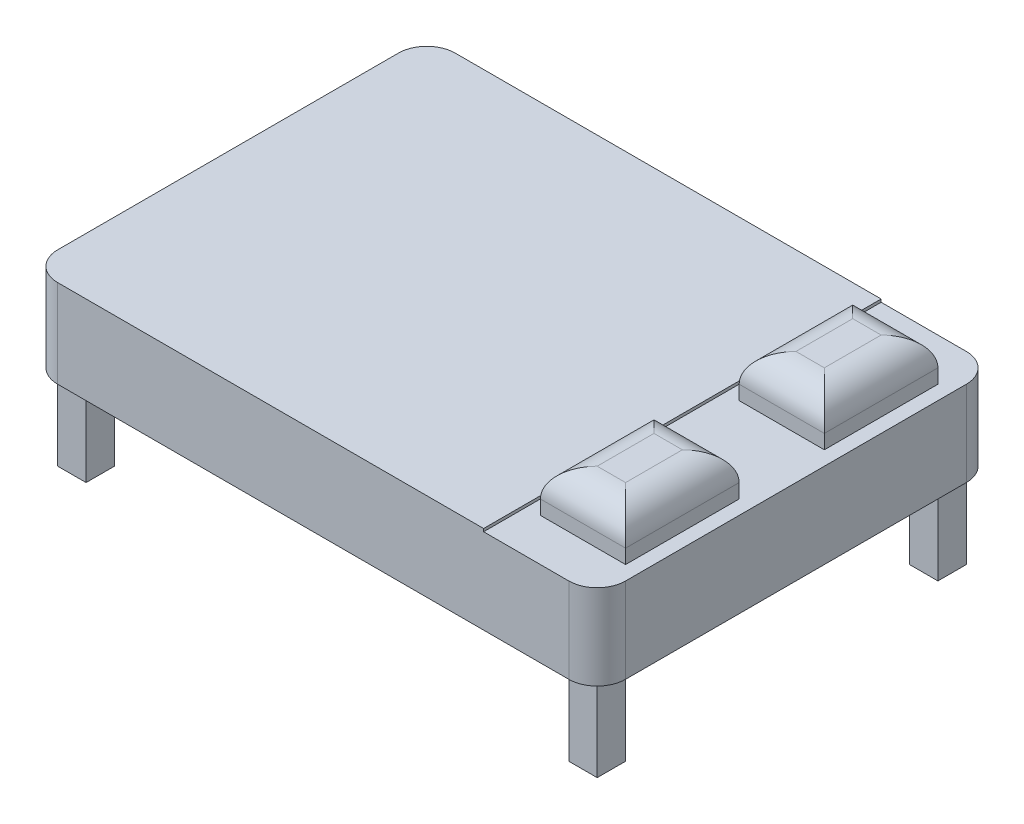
SolidWorks part; units mm, degrees
ref_plane "Plan de face" through (0, 0, 0) normal (0, 0, 1) x (1, 0, 0)
ref_plane "Plan de dessus" through (0, 0, 0) normal (0, 1, 0) x (1, 0, 0)
ref_plane "Plan de droite" through (0, 0, 0) normal (1, 0, 0) x (0, 0, -1)
sketch "Esquisse1" plane through (0, 0, 0) normal (0, 1, 0) x (1, 0, 0)
  line L1 (1000, -700) -> (-1000, -700)
  line L2 (1000, -700) -> (1000, 700)
  line L3 (1000, 700) -> (-1000, 700)
  line L4 (-1000, -700) -> (-1000, 700)
  line L5 (1000, -700) -> (-1000, 700) construction
  line L6 (1000, 700) -> (-1000, -700) construction
  point P0 (0, 0)
  dimension "D1" = 2000
  dimension "D2" = 1400
extrude "Boss.-Extru.1" add sketch "Esquisse1" along normal blind 300
sketch "Esquisse2" plane through (0, 0, 0) normal (0, -1, 0) x (1, 0, 0)
  line L0 (-1000, 700) -> (1000, 700) construction
  line L1 (-950, 650) -> (-850, 650)
  line L2 (-950, 650) -> (-950, 550)
  line L3 (-950, 550) -> (-850, 550)
  line L4 (-850, 650) -> (-850, 550)
  line L5 (-950, 650) -> (-850, 550) construction
  line L6 (-950, 550) -> (-850, 650) construction
  line L7 (-1000, -700) -> (-1000, 700) construction
  point P0 (-900, 600)
  dimension "D1" = 100
  dimension "D2" = 100
  dimension "D3" = 50
  dimension "D4" = 50
extrude "Boss.-Extru.2" add sketch "Esquisse2" along normal blind 300
mirror "Symétrie1" about plane through (0, 0, 0) normal (0, 0, 1) of "Boss.-Extru.2"
mirror "Symétrie2" about plane through (0, 0, 0) normal (1, 0, 0) of "Symétrie1", "Boss.-Extru.2"
sketch "Esquisse3" plane through (0, 300, 0) normal (0, 1, 0) x (1, 0, 0)
  line L0 (-1000, -700) -> (1000, -700) construction
  line L1 (-1000, 700) -> (600, 700)
  line L2 (-1000, 700) -> (-1000, -700)
  line L3 (-1000, -700) -> (600, -700)
  line L4 (600, 700) -> (600, -700)
  dimension "D1" = 1600
extrude "Boss.-Extru.3" add sketch "Esquisse3" along normal blind 10
sketch "Esquisse4" plane through (0, 300, 0) normal (0, 1, 0) x (1, 0, 0)
  line L0 (1000, -700) -> (1000, 700) construction
  line L1 (650, 550) -> (950, 550)
  line L2 (650, 550) -> (650, 150)
  line L3 (650, 150) -> (950, 150)
  line L4 (950, 550) -> (950, 150)
  line L5 (650, -150) -> (950, -150)
  line L6 (650, -150) -> (650, -550)
  line L7 (650, -550) -> (950, -550)
  line L8 (950, -150) -> (950, -550)
  line L9 (600, -700) -> (1000, -700) construction
  line L10 (1000, 700) -> (600, 700) construction
  dimension "D1" = 400
  dimension "D2" = 400
  dimension "D3" = 300
  dimension "D4" = 300
  dimension "D5" = 50
  dimension "D6" = 50
  dimension "D7" = 150
  dimension "D8" = 150
extrude "Boss.-Extru.4" add sketch "Esquisse4" along normal blind 150
fillet "Congé1" radius 100 8 edges at (800, 450, -550) (950, 450, -350) (800, 450, -150) (650, 450, -350) (800, 450, 150) (950, 450, 350) (800, 450, 550) (650, 450, 350)
fillet "Congé2" radius 100 4 edges at (1000, 150, -700) (-1000, 155, -700) (1000, 150, 700) (-1000, 155, 700)
